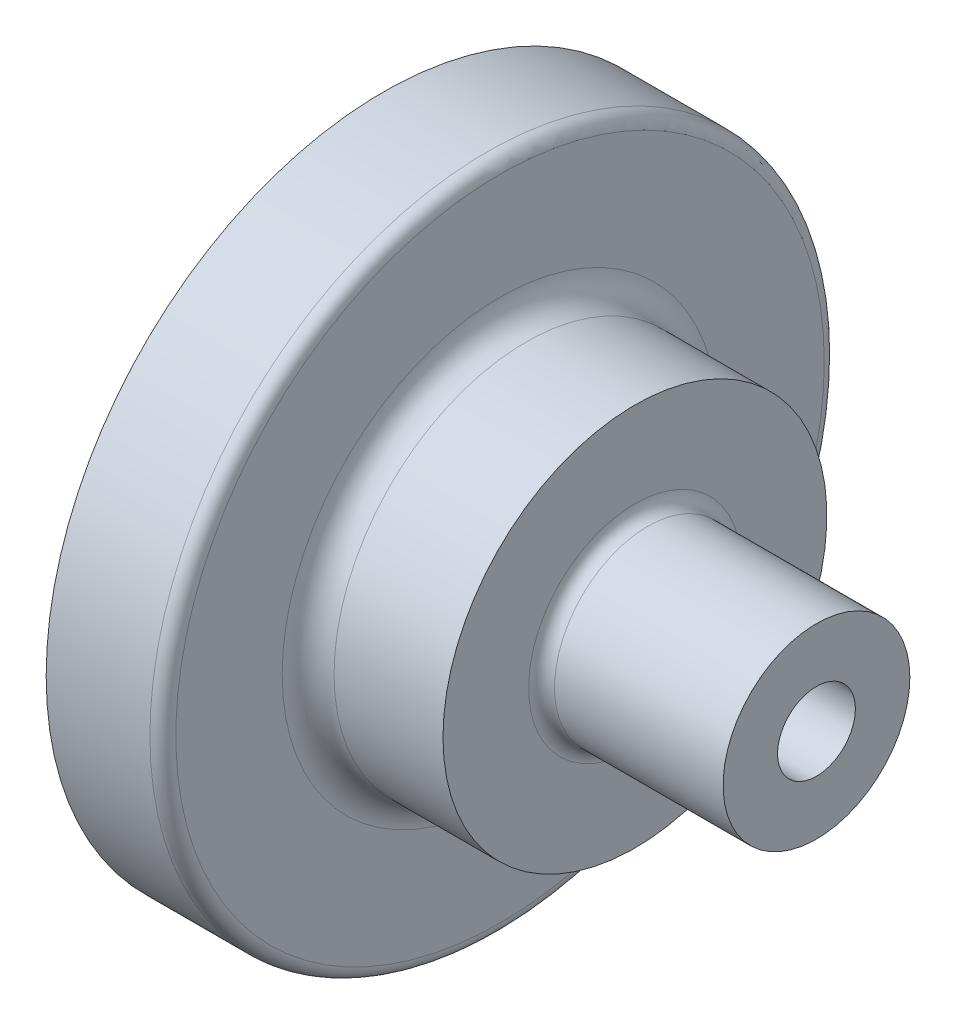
SolidWorks part; units mm, degrees
ref_plane "Front Plane" through (0, 0, 0) normal (0, 0, 1) x (1, 0, 0)
ref_plane "Top Plane" through (0, 0, 0) normal (0, 1, 0) x (1, 0, 0)
ref_plane "Right Plane" through (0, 0, 0) normal (1, 0, 0) x (0, 0, -1)
sketch "Schizzo1" plane through (0, 0, 0) normal (1, 0, 0) x (0, 0, -1)
  circle A0 centre (0, 0) radius 130
  dimension "D1" = 260
extrude "Estrusione-Estrusione1" add sketch "Schizzo1" along normal blind 45
sketch "Schizzo3" plane through (0, 0, 0) normal (-1, 0, 0) x (0, 0, 1)
  circle A0 centre (0, 0) radius 98
  circle A1 centre (0, 0) radius 85
  dimension "D1" = 170
  dimension "D2" = 196
extrude "Estrusione-Estrusione2" add sketch "Schizzo3" along normal blind 6
fillet "Raccordo1" radius 5 1 edges at (45, 0, -130)
sketch "Schizzo8" plane through (45, 0, 0) normal (1, 0, 0) x (0, 0, -1)
  circle A0 centre (0, 0) radius 74
  dimension "D1" = 148
extrude "Estrusione-Estrusione3" add sketch "Schizzo8" along normal blind 52
fillet "Raccordo2" radius 10 1 edges at (45, 0, -74)
sketch "Schizzo9" plane through (97, 0, 0) normal (1, 0, 0) x (0, 0, -1)
  circle A0 centre (0, 0) radius 36
  dimension "D1" = 72
extrude "Estrusione-Estrusione4" add sketch "Schizzo9" along normal blind 70
hole_wizard "Foro filettato M30x1.5-1" positions "Schizzo6" profile "Schizzo5" tap size "M30x1.5" standard "DIN"
sketch "Schizzo6" plane through (167, 0, 0) normal (1, 0, 0) x (0, 0, -1)
  point P0 (0, 0)
  point P3 (0, 0)
sketch "Schizzo5" plane through (167, 0, 0) normal (0, 1, 0) x (0, 0, -1)
  line L0 (0, 0) -> (0, 43.5623)
  line L1 (0, 43.5623) -> (14.25, 35)
  line L2 (14.25, 35) -> (14.25, 0)
  line L5 (14.25, 0) -> (0, 0)
  line L10 (0, 43.5623) -> (-14.25, 35) construction
  line L11 (0, -6.35) -> (0, 107.95) construction
  dimension "Tap Drill Dia." = 28.5
  dimension "Tap Drill Depth" = 35
  dimension "Drill Angle" = 118
fillet "Raccordo4" radius 5 1 edges at (97, 0, -36)
sketch "Schizzo10" plane through (45, 0, 0) normal (1, 0, 0) x (0, 0, -1)
  line L0 (0, 0) -> (-104.6538, 0) construction
  line L1 (0, 0) -> (-99.5316, -32.3398) construction
  circle A0 centre (0, 0) radius 104.6538 construction
  circle A1 centre (-99.5316, -32.3398) radius 13.5
  circle A2 centre (-99.5316, 32.3398) radius 13.5
  circle A3 centre (-61.5139, 84.6667) radius 13.5
  circle A4 centre (0, 104.6538) radius 13.5
  circle A5 centre (61.5139, 84.6667) radius 13.5
  circle A6 centre (99.5316, 32.3398) radius 13.5
  circle A7 centre (99.5316, -32.3398) radius 13.5
  circle A8 centre (61.5139, -84.6667) radius 13.5
  circle A9 centre (0, -104.6538) radius 13.5
  circle A10 centre (-61.5139, -84.6667) radius 13.5
  point P27 (0, 0)
  dimension "D2" = 27
  dimension "D1" = 18
  dimension "D3" = 10
sketch "Schizzo11" [suppressed] plane through (167, 0, 0) normal (1, 0, 0) x (0, 0, -1)
  circle A0 centre (0, 0) radius 12.5
  dimension "D1" = 25
extrude "Taglio-Estrusione1" [suppressed] cut sketch "Schizzo11" against normal through all
hole_wizard "Foro filettato M33-1" positions "Schizzo3D1" profile "Schizzo12" tap size "M33" standard "DIN"
sketch3d "Schizzo3D1"
  point P0 (0, 0, 0)
sketch "Schizzo12" plane through (0, 0, 0) normal (0, 1, 0) x (0, 0, 1)
  line L0 (0, 0) -> (0, 44.3133)
  line L1 (0, 44.3133) -> (15.5, 35)
  line L2 (15.5, 35) -> (15.5, 0)
  line L5 (15.5, 0) -> (0, 0)
  line L10 (0, 44.3133) -> (-15.5, 35) construction
  line L11 (0, -6.35) -> (0, 107.95) construction
  dimension "Tap Drill Dia." = 31
  dimension "Tap Drill Depth" = 35
  dimension "Drill Angle" = 118
sketch "Sketch1" plane through (167, 0, 0) normal (1, 0, 0) x (0, 0, -1)
  circle A0 centre (0, 0) radius 15
extrude "Cut-Extrude1" cut sketch "Sketch1" against normal through all
